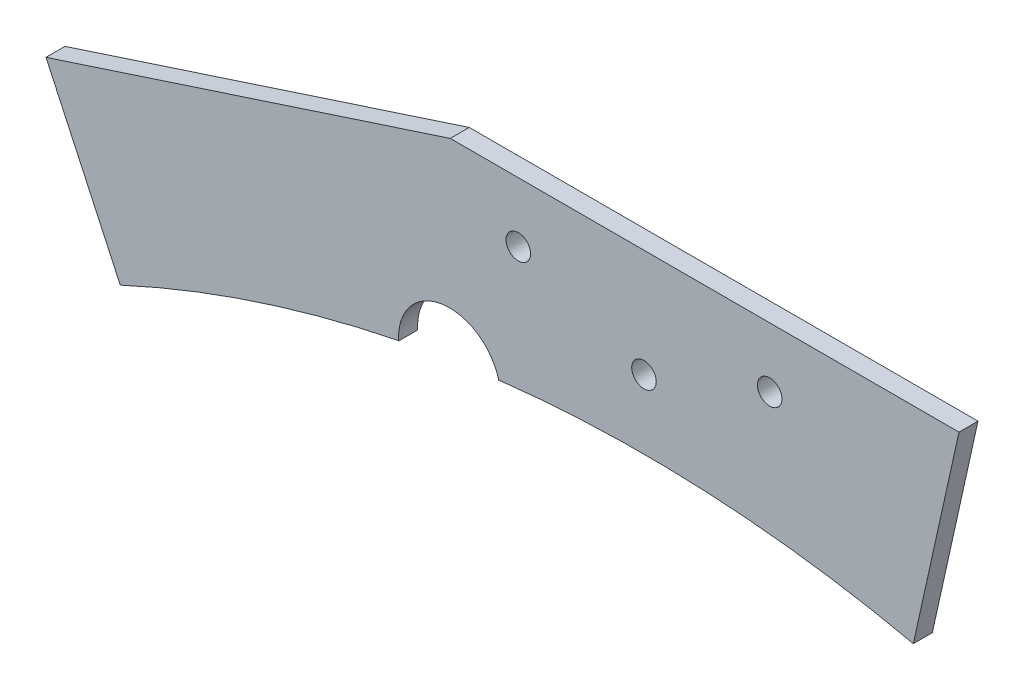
SolidWorks part; units mm, degrees
ref_plane "Front Plane" through (0, 0, 0) normal (0, 0, 1) x (1, 0, 0)
ref_plane "Top Plane" through (0, 0, 0) normal (0, 1, 0) x (1, 0, 0)
ref_plane "Right Plane" through (0, 0, 0) normal (1, 0, 0) x (0, 0, -1)
sketch "Sketch3" plane through (0, 0, 0) normal (0, 0, 1) x (1, 0, 0)
  circle A0 centre (0, 439) radius 4.1
  dimension "D2" = 8.2
  dimension "D1" = 439
sketch "Sketch4" plane through (0, 0, 0) normal (0, 0, 1) x (1, 0, 0)
  line L0 (90, 406.1478) -> (105.2573, 475)
  line L1 (-175, 377.4003) -> (-220.2568, 475)
  line L2 (-220.2568, 475) -> (105.2573, 475)
  line L3 (0, 0) -> (0, 618.1752) construction
  arc A0 (90, 406.1478) -> (-175, 377.4003) centre (0, 0) ccw
  dimension "D1" = 416
  dimension "D2" = 175
  dimension "D3" = 90
  dimension "D4" = 475
extrude "Boss-Extrude1" add sketch "Sketch4" along normal blind 6.35
sketch "Sketch6" plane through (0, 0, 6.35) normal (0, 0, 1) x (1, 0, 0)
  circle A0 centre (0, 439) radius 4.1 construction
  circle A1 centre (0, 439) radius 4.1
extrude "Cut-Extrude1" cut sketch "Sketch6" against normal through all
sketch "Sketch8" plane through (0, 0, 6.35) normal (0, 0, 1) x (1, 0, 0)
  circle A1 centre (42, 455) radius 4.1
  circle A2 centre (-42, 455) radius 4.1
  circle A3 centre (0, 439) radius 4.1 construction
  dimension "D1" = 42
  dimension "D2" = 42
  dimension "D3" = 16
  dimension "D5" = 16
  dimension "D6" = 8.2
  dimension "D7" = 8.2
extrude "Cut-Extrude2" cut sketch "Sketch8" against normal through all
sketch "Sketch11" plane through (0, 0, 6.35) normal (0, 0, 1) x (1, 0, 0)
  line L0 (-199.8197, 430.9258) -> (-64.7427, 475)
  line L1 (-220.2568, 475) -> (-175, 377.4003) construction
  line L2 (105.2573, 475) -> (-220.2568, 475) construction
  dimension "D1" = 59
  dimension "D2" = 170
extrude "Cut-Extrude3" cut sketch "Sketch11" against normal through all and the other way through all
sketch "Sketch10" plane through (0, 0, 0) normal (0, 0, 1) x (1, 0, 0)
  line L0 (-81.9647, 407.7703) -> (-82.0456, 407.829)
  line L1 (-48.5321, 413.0853) -> (-48.4733, 413.1662)
  line L2 (0, 0) -> (-65, 408.8655) construction
  line L6 (90, 406.1478) -> (105.2573, 475)
  line L7 (105.2573, 475) -> (-64.7427, 475)
  line L8 (-199.8197, 430.9258) -> (-175, 377.4003)
  line L10 (-64.7427, 475) -> (-199.8197, 430.9258)
  line L11 (-64.7427, 475) -> (-199.8197, 430.9258)
  arc A0 (-48.5321, 413.0853) -> (-81.9647, 407.7703) centre (-65, 408.8655) ccw
  arc A1 (90, 406.1478) -> (-175, 377.4003) centre (0, 0) ccw construction
  arc A3 (90, 406.1478) -> (-175, 377.4003) centre (0, 0) ccw
  arc A4 (-48.4733, 413.1662) -> (-82.0456, 407.829) centre (0, 0) ccw
  dimension "D1" = 17
  dimension "D4" = 65
  dimension "D5" = 414
  dimension "D2" = 0.1
  dimension "D3" = 0.1
  dimension "D6" = 90
  dimension "D7" = 45
  dimension "D8" = 0
sketch "Sketch12" plane through (0, 0, 6.35) normal (0, 0, 1) x (1, 0, 0)
  arc A0 (-48.5321, 413.0853) -> (-81.9647, 407.7703) centre (-65, 408.8655) ccw construction
  arc A1 (-48.4733, 413.1662) -> (-82.0456, 407.829) centre (0, 0) ccw construction
  arc A2 (-48.5506, 413.1572) -> (-81.9693, 407.8444) centre (-65, 408.8655) ccw
  arc A3 (-48.5506, 413.1572) -> (-81.9693, 407.8444) centre (0, 0) ccw
extrude "Cut-Extrude8" cut sketch "Sketch12" against normal through all
sketch "Sketch13" plane through (0, 0, 0) normal (0, 0, 1) x (1, 0, 0)
  line L0 (-81.9647, 407.7703) -> (-82.0456, 407.829) construction
  line L1 (-48.5321, 413.0853) -> (-48.4733, 413.1662) construction
  line L2 (-81.9647, 407.7703) -> (-82.0456, 407.829)
  line L3 (-48.5321, 413.0853) -> (-48.4733, 413.1662)
  arc A0 (-48.5321, 413.0853) -> (-81.9647, 407.7703) centre (-65, 408.8655) ccw construction
  arc A1 (-48.4733, 413.1662) -> (-82.0456, 407.829) centre (0, 0) ccw construction
  arc A2 (-48.5321, 413.0853) -> (-48.5506, 413.1572) centre (-65, 408.8655) ccw
  arc A3 (-48.4733, 413.1662) -> (-48.5506, 413.1572) centre (0, 0) ccw
  arc A4 (-81.9693, 407.8444) -> (-82.0456, 407.829) centre (0, 0) ccw
  arc A5 (-81.9693, 407.8444) -> (-81.9647, 407.7703) centre (-65, 408.8655) ccw
extrude "Boss-Extrude3" add sketch "Sketch13" along normal up to surface (6.35 mm away)
